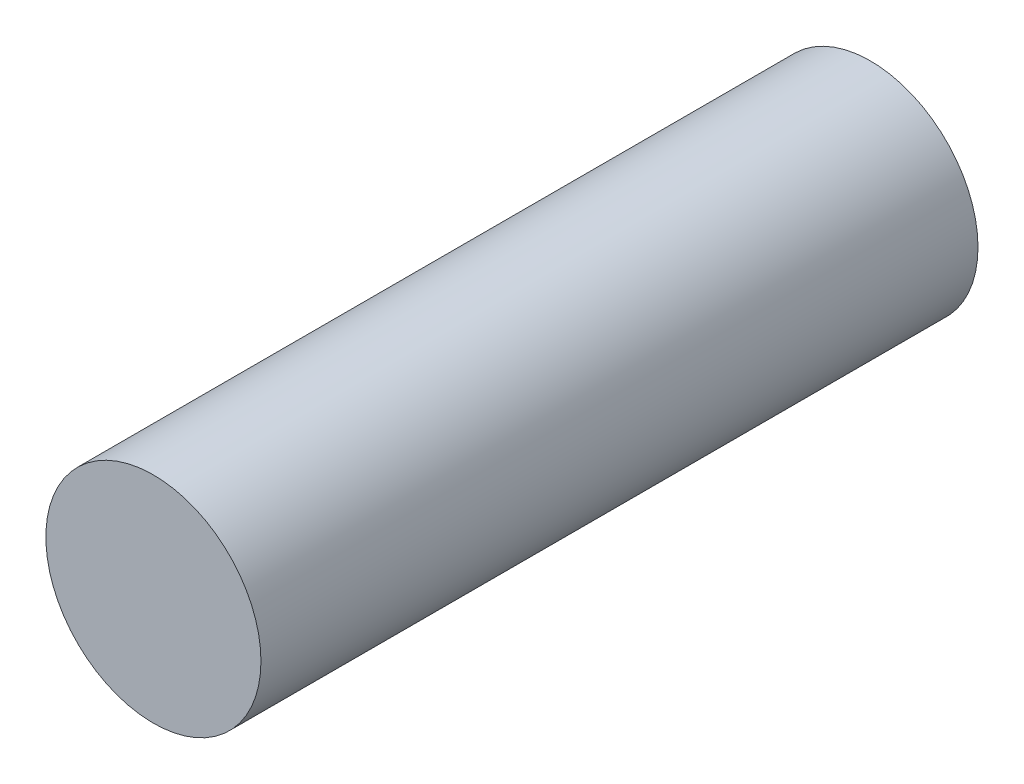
SolidWorks part; units mm, degrees
ref_plane "Front Plane" through (0, 0, 0) normal (0, 0, 1) x (1, 0, 0)
ref_plane "Top Plane" through (0, 0, 0) normal (0, 1, 0) x (1, 0, 0)
ref_plane "Right Plane" through (0, 0, 0) normal (1, 0, 0) x (0, 0, -1)
sketch "Sketch1" plane through (0, 0, 0) normal (0, 0, 1) x (1, 0, 0)
  circle A0 centre (0, 0) radius 1.5
  dimension "D1" = 3
extrude "Boss-Extrude1" add sketch "Sketch1" along normal blind 10
